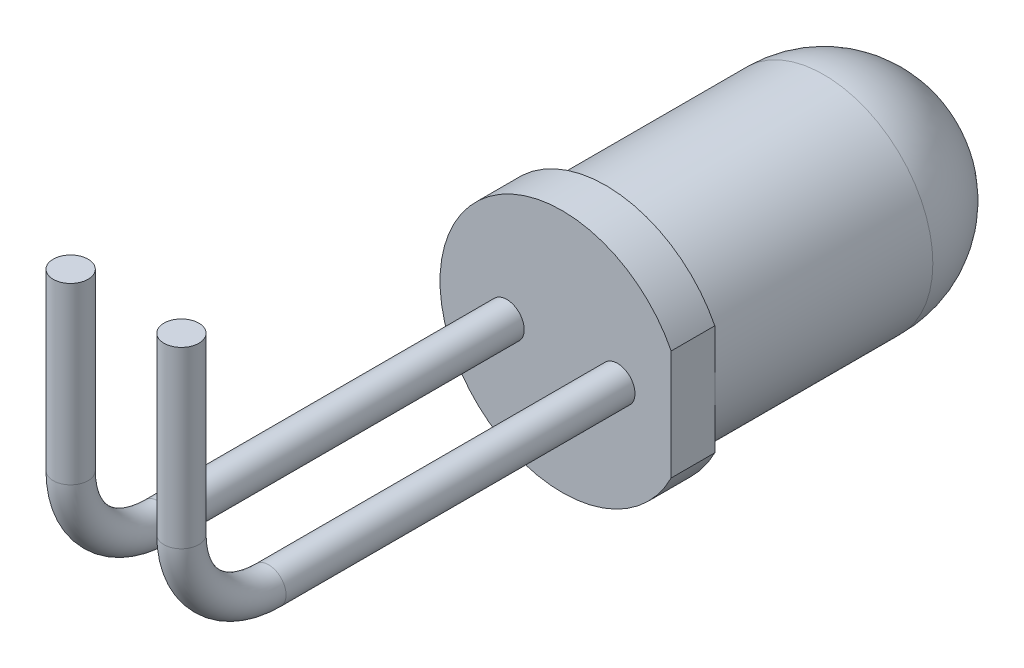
SolidWorks part; units mm, degrees
ref_plane "Face" through (0, 0, 0) normal (0, 0, 1) x (1, 0, 0)
ref_plane "Dessus" through (0, 0, 0) normal (0, 1, 0) x (1, 0, 0)
ref_plane "Droite" through (0, 0, 0) normal (1, 0, 0) x (0, 0, -1)
sketch "Esquisse1" plane through (0, 0, 0) normal (0, 0, 1) x (1, 0, 0)
  circle A0 centre (0, 0) radius 2.5
extrude "Base-Extrusion" add sketch "Esquisse1" along normal blind 8.5
sketch "Esquisse2" plane through (0, 0, 8.5) normal (0, 0, 1) x (1, 0, 0)
  line L0 (2.5, -2.4917) -> (2.5, 2.5621) construction
  line L1 (2.5, 1.261) -> (2.5, -1.261)
  arc A0 (2.5, 1.261) -> (2.5, -1.261) centre (0, 0) ccw
extrude "Boss.-Extru.1" add sketch "Esquisse2" against normal blind 1
fillet "Congé1" radius 2.5 1 edges at (2.5, 0, 0)
sketch "Esquisse3" plane through (0, 0, 8.5) normal (0, 0, 1) x (1, 0, 0)
  line L0 (2.8791, 0) -> (-3.5821, 0) construction
  line L1 (0, -2.9335) -> (0, 2.9813) construction
  line L2 (1.27, -0.8777) -> (1.27, 1.5607) construction
  circle A0 centre (1.27, 0) radius 0.4
  dimension "D1" = 1.27
ref_plane "Plan1" through (1.27, 0, 0) normal (1, 0, 0) x (0, 0, -1)
sketch "Esquisse5" plane through (1.27, 0, 0) normal (1, 0, 0) x (0, 0, -1)
  line L0 (-8.5, -5.3883) -> (-8.5, 4.4127) construction
  line L1 (-18.5, 9.2152) -> (-18.5, -2.555) construction
  line L2 (1.3145, 0) -> (-22.6036, 0) construction
  line L3 (-22.6036, 6) -> (-12.2793, 6) construction
  line L4 (-8.5, 0) -> (-16.5, 0)
  line L5 (-18.5, 2) -> (-18.5, 6)
  arc A0 (-16.5, 0) -> (-18.5, 2) centre (-16.5, 2) cw
  dimension "D3" = 2
  dimension "D1" = 10
  dimension "D2" = 6
ref_plane "Plan2" through (0, 0, 0) normal (1, 0, 0) x (0, 0, -1)
sweep "Balayage1" add profiles "Esquisse3" path "Esquisse5"
mirror "Symétrie1" about plane through (0, 0, 0) normal (1, 0, 0) of "Balayage1"
